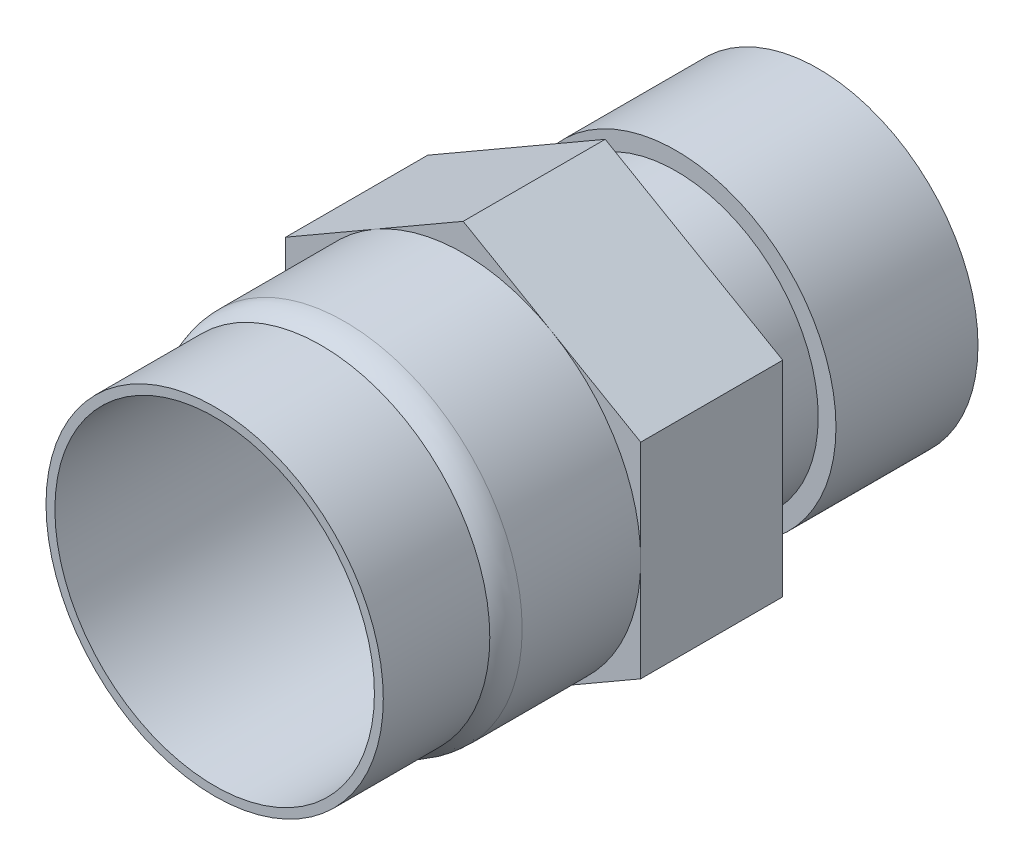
SolidWorks part; units mm, degrees
ref_plane "Plan de face" through (0, 0, 0) normal (0, 0, 1) x (1, 0, 0)
ref_plane "Plan de dessus" through (0, 0, 0) normal (0, 1, 0) x (1, 0, 0)
ref_plane "Plan de droite" through (0, 0, 0) normal (1, 0, 0) x (0, 0, -1)
sketch "Esquisse1" plane through (0, 0, 0) normal (0, 0, 1) x (1, 0, 0)
  circle A0 centre (0, 0) radius 5
  dimension "D1" = 10
extrude "Extrusion1" add sketch "Esquisse1" along normal blind 4
sketch "Esquisse2" plane through (0, 0, 4) normal (0, 0, 1) x (1, 0, 0)
  circle A0 centre (0, 0) radius 4.75
  dimension "D1" = 9.5
extrude "Extrusion2" add sketch "Esquisse2" along normal blind 3
sketch "Esquisse3" plane through (0, 0, 0) normal (0, 0, -1) x (-1, 0, 0)
  line L1 (0, 5.7735) -> (-5, 2.8868)
  line L2 (-5, 2.8868) -> (-5, -2.8868)
  line L3 (-5, -2.8868) -> (0, -5.7735)
  line L4 (0, -5.7735) -> (5, -2.8868)
  line L5 (5, -2.8868) -> (5, 2.8868)
  line L6 (5, 2.8868) -> (0, 5.7735)
  circle A0 centre (0, 0) radius 5 construction
  dimension "D1" = 10
extrude "Extrusion3" add sketch "Esquisse3" along normal blind 4
sketch "Esquisse4" plane through (0, 0, -4) normal (0, 0, -1) x (-1, 0, 0)
  circle A0 centre (0, 0) radius 4
  dimension "D1" = 8
extrude "Extrusion4" add sketch "Esquisse4" along normal blind 2
sketch "Esquisse5" plane through (0, 0, -6) normal (0, 0, -1) x (-1, 0, 0)
  circle A0 centre (0, 0) radius 4.5
  dimension "D1" = 9
extrude "Extrusion5" add sketch "Esquisse5" along normal blind 4
sketch "Esquisse6" plane through (0, 0, -4) normal (0, 0, -1) x (-1, 0, 0)
  circle A0 centre (0, 0) radius 4.75
  circle A2 centre (0, 0) radius 4
  dimension "D1" = 9.5
  dimension "D2" = 8
extrude "Enlèv. mat.-Extru.1" cut sketch "Esquisse6" against normal blind 0.5
fillet "Congé1" radius 1 1 edges at (5, 0, 4)
sketch "Esquisse7" plane through (0, 0, 7) normal (0, 0, 1) x (1, 0, 0)
  circle A0 centre (0, 0) radius 4.5
  dimension "D1" = 9
extrude "Enlèv. mat.-Extru.2" cut sketch "Esquisse7" against normal blind 10
sketch "Esquisse8" plane through (0, 0, -10) normal (0, 0, -1) x (-1, 0, 0)
  circle A0 centre (0, 0) radius 3.25
  dimension "D1" = 6.5
extrude "Enlèv. mat.-Extru.3" cut sketch "Esquisse8" against normal blind 10
equation "\"D1@Esquisse5\" = 9"
